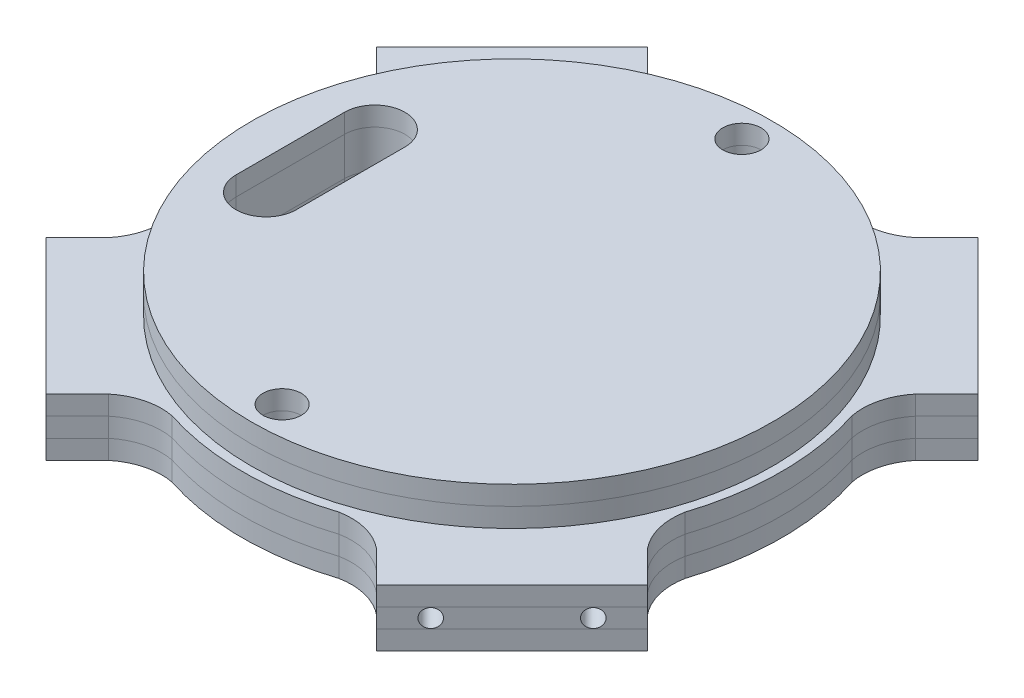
SolidWorks part; units mm, degrees
ref_plane "Front Plane" through (0, 0, 0) normal (0, 0, 1) x (1, 0, 0)
ref_plane "Top Plane" through (0, 0, 0) normal (0, 1, 0) x (1, 0, 0)
ref_plane "Right Plane" through (0, 0, 0) normal (1, 0, 0) x (0, 0, -1)
sketch "Sketch1" plane through (0, 0, 0) normal (0, 1, 0) x (1, 0, 0)
  circle A0 centre (0, 0) radius 43.18
  dimension "D1" = 86.36
extrude "Boss-Extrude1" add sketch "Sketch1" along normal blind 3.175
sketch "Sketch11" plane through (0, 3.175, 0) normal (0, 1, 0) x (1, 0, 0)
  circle A0 centre (0, 0) radius 43.18
extrude "Boss-Extrude5" add sketch "Sketch11" along normal blind 3.175 separate body
sketch "Sketch2" plane through (0, 0, 0) normal (0, 1, 0) x (1, 0, 0)
  circle A0 centre (0, 0) radius 57.15
  dimension "D1" = 114.3
extrude "Boss-Extrude2" add sketch "Sketch2" against normal blind 3.175
sketch "Sketch9" plane through (0, -3.175, 0) normal (0, -1, 0) x (1, 0, 0)
  circle A0 centre (0, 0) radius 57.15
extrude "Boss-Extrude3" add sketch "Sketch9" along normal blind 3.175 separate body
sketch "Sketch10" plane through (0, -6.35, 0) normal (0, -1, 0) x (-1, 0, 0)
  circle A0 centre (0, 0) radius 57.15
extrude "Boss-Extrude4" add sketch "Sketch10" along normal blind 3.175 separate body
sketch "Sketch4" plane through (0, 0, 0) normal (0, 1, 0) x (1, 0, 0)
  circle A0 centre (0, 0) radius 44.704
  dimension "D1" = 89.408
sketch "Sketch5" plane through (0, 3.175, 0) normal (0, 1, 0) x (1, 0, 0)
  circle A0 centre (0, 38.1) radius 3.175
  dimension "D1" = 6.35
  dimension "D2" = 38.1
extrude "Cut-Extrude2" cut sketch "Sketch5" against normal through all both and the other way through all
mirror "Mirror1" about plane through (0, 0, 0) normal (0, 0, 1) of "Cut-Extrude2"
ref_plane "Plane1" through (0, 0, 0) normal (-0.7071, 0, 0.7071) x (0.7071, 0, 0.7071)
ref_plane "Plane2" through (-40.4112, 0, -40.4112) normal (-0.7071, 0, -0.7071) x (-0.7071, 0, 0.7071)
sketch "Sketch6" plane through (-40.4112, 0, -40.4112) normal (-0.7071, 0, -0.7071) x (-0.7071, 0, 0.7071)
  line L0 (-15.875, 0) -> (15.875, 0)
  line L1 (44.704, 0) -> (-44.704, 0) construction
  line L2 (15.875, 0) -> (15.875, -9.525)
  line L4 (15.875, -9.525) -> (-15.875, -9.525)
  line L5 (-15.875, -9.525) -> (-15.875, 0)
  point P6 (0, 0)
  dimension "D1" = 31.75
  dimension "D2" = 9.525
extrude "Cut-Extrude3" cut sketch "Sketch6" against normal blind 2.54
pattern_circular "CirPattern1" count 4 over 360 about axis through (0, 0, 0) along (0, 1, 0) of "Cut-Extrude3"
sketch "Sketch12" plane through (-38.6151, 0, -38.6151) normal (-0.7071, 0, -0.7071) x (-0.7071, 0, 0.7071)
  line L0 (-15.875, -9.525) -> (15.875, -9.525) construction
  line L1 (15.875, -3.175) -> (15.875, -6.35) construction
  line L2 (-15.875, -6.35) -> (-15.875, -3.175) construction
  circle A0 centre (9.525, -4.7625) radius 1.5
  circle A1 centre (-9.525, -4.7625) radius 1.5
  dimension "D1" = 3
  dimension "D2" = 4.7625
  dimension "D3" = 6.35
  dimension "D4" = 6.35
extrude "Cut-Extrude5" cut sketch "Sketch12" against normal blind 12
sketch "Sketch14" plane through (0, 0, 0) normal (0, 1, 0) x (1, 0, 0)
  line L0 (50.0461, -27.5955) -> (44.658, -22.2073)
  line L1 (49.8404, -27.3898) -> (50.0461, -27.5955) construction
  line L2 (50.0461, 27.5955) -> (44.658, 22.2073)
  line L3 (49.8404, 27.3898) -> (50.0461, 27.5955) construction
  line L4 (0, 0) -> (12.0176, 0) construction
  line L5 (0, 0) -> (42.516, -13.8143) construction
  line L6 (0, 0) -> (42.516, 13.8143) construction
  line L7 (-27.5955, -50.0461) -> (-22.2073, -44.658)
  line L8 (27.5955, -50.0461) -> (22.2073, -44.658)
  line L9 (-50.0461, 27.5955) -> (-44.658, 22.2073)
  line L10 (-50.0461, -27.5955) -> (-44.658, -22.2073)
  line L11 (27.5955, 50.0461) -> (22.2073, 44.658)
  line L12 (-27.5955, 50.0461) -> (-22.2073, 44.658)
  circle A0 centre (0, 0) radius 44.704 construction
  arc A1 (50.0461, -27.5955) -> (50.0461, 27.5955) centre (0, 0) ccw
  arc A2 (44.658, -22.2073) -> (42.516, -13.8143) centre (52.4922, -15.7382) cw
  arc A3 (44.658, 22.2073) -> (42.516, 13.8143) centre (52.4922, 15.7382) ccw
  arc A4 (42.516, 13.8143) -> (42.516, -13.8143) centre (0, 0) cw
  arc A5 (13.8143, -42.516) -> (-13.8143, -42.516) centre (0, 0) cw
  arc A6 (-22.2073, -44.658) -> (-13.8143, -42.516) centre (-15.7382, -52.4922) cw
  arc A7 (-27.5955, -50.0461) -> (27.5955, -50.0461) centre (0, 0) ccw
  arc A8 (22.2073, -44.658) -> (13.8143, -42.516) centre (15.7382, -52.4922) ccw
  arc A9 (-42.516, -13.8143) -> (-42.516, 13.8143) centre (0, 0) cw
  arc A10 (-44.658, 22.2073) -> (-42.516, 13.8143) centre (-52.4922, 15.7382) cw
  arc A11 (-50.0461, 27.5955) -> (-50.0461, -27.5955) centre (0, 0) ccw
  arc A12 (-44.658, -22.2073) -> (-42.516, -13.8143) centre (-52.4922, -15.7382) ccw
  arc A13 (-13.8143, 42.516) -> (13.8143, 42.516) centre (0, 0) cw
  arc A14 (22.2073, 44.658) -> (13.8143, 42.516) centre (15.7382, 52.4922) cw
  arc A15 (27.5955, 50.0461) -> (-27.5955, 50.0461) centre (0, 0) ccw
  arc A16 (-22.2073, 44.658) -> (-13.8143, 42.516) centre (-15.7382, 52.4922) ccw
  point P47 (0, 0)
  dimension "D1" = 89.408
  dimension "D4" = 10.16
  dimension "D6" = 10.16
  dimension "D2" = 7.62
  dimension "D3" = 7.62
  dimension "D5" = 18
  dimension "D7" = 18
  dimension "D8" = 4
extrude "Cut-Extrude7" cut sketch "Sketch14" against normal through all
pattern_circular "CirPattern25" count 4 over 360 about axis through (0, 0, 0) along (0, 1, 0) of "Cut-Extrude5"
sketch "Sketch15" plane through (0, -9.525, 0) normal (0, -1, 0) x (-1, 0, 0)
  line L0 (31.75, 9) -> (31.75, -9) construction
  line L1 (36.75, 9) -> (36.75, -9)
  line L2 (26.75, 9) -> (26.75, -9)
  arc A0 (36.75, 9) -> (26.75, 9) centre (31.75, 9) ccw
  arc A1 (26.75, -9) -> (36.75, -9) centre (31.75, -9) ccw
  point P2 (31.75, 0)
  dimension "D1" = 10
  dimension "D2" = 18
  dimension "D3" = 31.75
extrude "Cut-Extrude8" cut sketch "Sketch15" against normal through all
